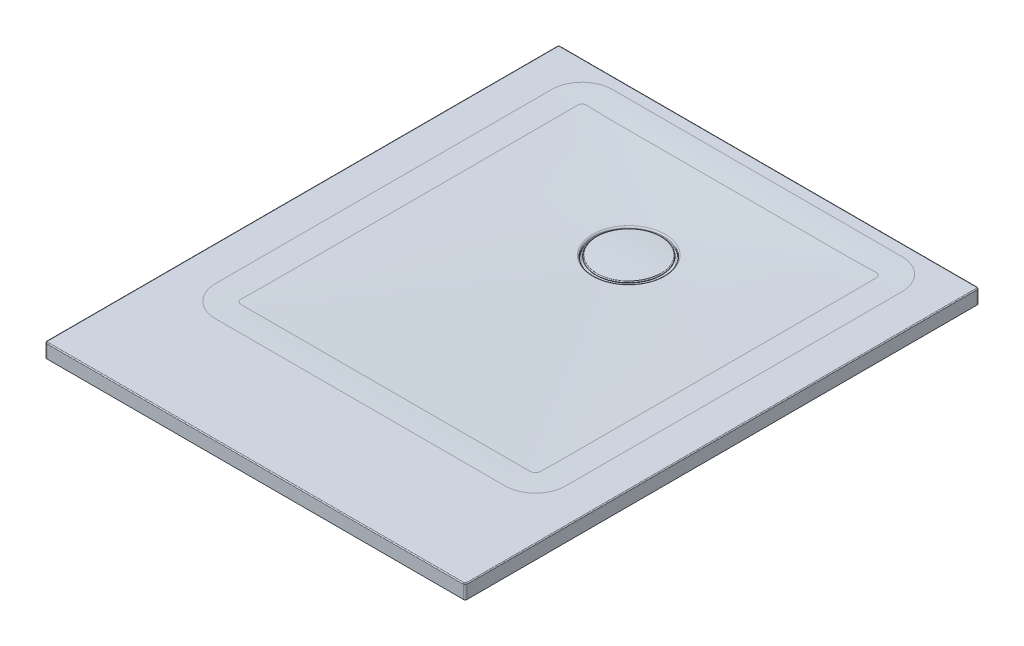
SolidWorks part; units mm, degrees
ref_plane "Płaszczyzna przednia" through (0, 0, 0) normal (0, 0, 1) x (1, 0, 0)
ref_plane "Płaszczyzna górna" through (0, 0, 0) normal (0, 1, 0) x (1, 0, 0)
ref_plane "Płaszczyzna prawa" through (0, 0, 0) normal (1, 0, 0) x (0, 0, -1)
sketch "Szkic2" plane through (0, 0, 0) normal (0, 1, 0) x (1, 0, 0)
  line L0 (0, 550) -> (0, 250) construction
  line L1 (-450, -550) -> (450, -550)
  line L2 (-450, -550) -> (-450, 550)
  line L3 (-450, 550) -> (450, 550)
  line L4 (450, -550) -> (450, 550)
  line L5 (-450, -550) -> (450, 550) construction
  line L6 (-450, 550) -> (450, -550) construction
  line L7 (-360, 510) -> (360, 510)
  line L8 (-360, 510) -> (-360, -310)
  line L9 (-360, -310) -> (360, -310)
  line L10 (360, 510) -> (360, -310)
  line L11 (-400, 550) -> (-400, -350) construction
  line L12 (-400, -350) -> (400, -350) construction
  line L13 (400, -350) -> (400, 550) construction
  circle A0 centre (0, 250) radius 75
  point P0 (0, 0)
  point P11 (0, 510)
  point P16 (0, -350)
  dimension "D9" = 150
  dimension "D1" = 900
  dimension "D2" = 1100
  dimension "D3" = 40
  dimension "D4" = 90
  dimension "D5" = 40
  dimension "D6" = 50
  dimension "D7" = 900
  dimension "D8" = 300
  dimension "D10" = 800
sketch "Szkic3" plane through (0, 0, 0) normal (0, 1, 0) x (1, 0, 0)
  line L0 (-450, -550) -> (-450, 550) construction
  line L1 (-450, -550) -> (450, -550) construction
  line L2 (450, -550) -> (450, 550) construction
  line L3 (-450, 550) -> (450, 550) construction
  line L4 (-360, 510) -> (-360, -310) construction
  line L5 (-360, 510) -> (360, 510) construction
  line L6 (360, 510) -> (360, -310) construction
  line L7 (-360, -310) -> (360, -310) construction
  line L8 (-450, -550) -> (-450, 550)
  line L9 (-450, -550) -> (450, -550)
  line L10 (450, -550) -> (450, 550)
  line L11 (-450, 550) -> (450, 550)
  line L12 (-360, 460) -> (-360, -260)
  line L13 (-310, 510) -> (310, 510)
  line L14 (360, 460) -> (360, -260)
  line L15 (-310, -310) -> (310, -310)
  arc A0 (360, 460) -> (310, 510) centre (310, 460) ccw
  arc A1 (-310, 510) -> (-360, 460) centre (-310, 460) ccw
  arc A2 (310, -310) -> (360, -260) centre (310, -260) ccw
  arc A3 (-310, -310) -> (-360, -260) centre (-310, -260) cw
  dimension "D1" = 50
surface "Powierzchnia-Płaszczyzna1" sketch "Szkic3"
sketch "Szkic4" plane through (0, 0, 0) normal (0, 1, 0) x (1, 0, 0)
  line L0 (-360, 510) -> (-360, -310) construction
  line L1 (-360, -310) -> (360, -310) construction
  line L2 (360, 510) -> (360, -310) construction
  line L3 (-360, 510) -> (360, 510) construction
  line L4 (-360, 510) -> (-360, -310)
  line L5 (-360, -310) -> (360, -310)
  line L6 (360, 510) -> (360, -310)
  line L7 (-360, 510) -> (360, 510)
ref_plane "korek" through (0, -15, 0) normal (0, 1, 0) x (-1, 0, 0)
sketch "Szkic5" plane through (0, -15, 0) normal (0, 1, 0) x (-1, 0, 0)
  circle A0 centre (0, -250) radius 75 construction
  circle A1 centre (0, -250) radius 75
surface "Powierzchnia-Wyciągnięcie po profilach2"
surface "Powierzchnia-Połącz1"
sketch "Szkic7" plane through (0, 0, 0) normal (0, 1, 0) x (1, 0, 0)
  line L27 (310, 470) -> (-310, 470)
  line L28 (-320, 460) -> (-320, -260)
  line L29 (-310, -270) -> (310, -270)
  line L30 (320, -260) -> (320, 460)
  line L31 (310, 470) -> (-310, 470)
  line L32 (-320, 460) -> (-320, -260)
  line L33 (-310, -270) -> (310, -270)
  line L34 (320, -260) -> (320, 460)
  line L35 (310, 525) -> (-310, 525)
  line L36 (-375, 460) -> (-375, -260)
  line L37 (-310, -325) -> (310, -325)
  line L38 (375, -260) -> (375, 460)
  line L39 (310, 525) -> (-310, 525)
  line L40 (-375, 460) -> (-375, -260)
  line L41 (-310, -325) -> (310, -325)
  line L42 (375, -260) -> (375, 460)
  arc A0 (320, -260) -> (310, -270) centre (310, -260) cw
  arc A1 (-320, -260) -> (-310, -270) centre (-310, -260) ccw
  arc A2 (320, 460) -> (310, 470) centre (310, 460) ccw
  arc A3 (-320, 460) -> (-310, 470) centre (-310, 460) cw
  spline S23 degree 3 poles (-642.6961, 189.4241) (147.1146, 360.1637) (326.7605, 426.9511) (319.745, 462.2677) (319.666, 462.5845) (319.4754, 463.2123) (319.3641, 463.5245) (318.988, 464.4323) (318.6811, 465.0064) (318.1375, 465.8214) (317.9415, 466.0861) (317.5237, 466.5957) (317.3039, 466.8381) (316.6125, 467.5299) (316.1097, 467.944) (315.2906, 468.4922) (315.0068, 468.6625) (314.43, 468.9712) (314.1355, 469.1107) (313.5344, 469.3602) (313.2278, 469.4704) (312.6024, 469.661) (312.2822, 469.7414) (250.628, 482.1043) (123.9223, -93.5703) (17.5595, -486.2828) knots -6.724081 -6.724081 -6.724081 -6.724081 0.125 0.125 0.1875 0.1875 0.25 0.25 0.375 0.375 0.4375 0.4375 0.5 0.5 0.625 0.625 0.6875 0.6875 0.75 0.75 0.8125 0.8125 0.875 0.875 12.74495 12.74495 12.74495 12.74495 only from (320, 460) to (310, 470)
  spline S24 degree 3 poles (-28.6406, -489.6017) (-195.2901, 254.275) (-273.2829, 477.5165) (-312.2676, 469.7447) (-312.5843, 469.6659) (-313.2123, 469.4757) (-313.5243, 469.3641) (-314.4322, 468.9881) (-315.0063, 468.6811) (-315.8213, 468.1376) (-316.086, 467.9415) (-316.5956, 467.5238) (-316.8381, 467.3039) (-317.5299, 466.6126) (-317.9438, 466.1097) (-318.4921, 465.2907) (-318.6624, 465.0069) (-318.9711, 464.4301) (-319.1106, 464.1355) (-319.3602, 463.5344) (-319.4701, 463.2278) (-319.6611, 462.6025) (-319.7417, 462.2823) (-328.5419, 418.2417) (-42.4867, 341.7495) (650.7615, 219.986) knots -7.443079 -7.443079 -7.443079 -7.443079 0.125 0.125 0.1875 0.1875 0.25 0.25 0.375 0.375 0.4375 0.4375 0.5 0.5 0.625 0.625 0.6875 0.6875 0.75 0.75 0.8125 0.8125 0.875 0.875 9.335128 9.335128 9.335128 9.335128 only from (-310, 470) to (-320, 460)
  spline S25 degree 3 poles (642.6962, 10.5759) (-147.1146, -160.1637) (-326.7605, -226.9511) (-319.745, -262.2677) (-319.666, -262.5845) (-319.4754, -263.2123) (-319.3641, -263.5245) (-318.988, -264.4323) (-318.6811, -265.0064) (-318.1375, -265.8214) (-317.9415, -266.0861) (-317.5237, -266.5957) (-317.3039, -266.8381) (-316.6125, -267.5299) (-316.1097, -267.944) (-315.2906, -268.4922) (-315.0068, -268.6625) (-314.43, -268.9712) (-314.1355, -269.1107) (-313.5344, -269.3602) (-313.2278, -269.4704) (-312.6025, -269.661) (-312.2822, -269.7414) (-250.628, -282.1043) (-123.9223, 293.5703) (-17.5595, 686.2828) knots -6.724081 -6.724081 -6.724081 -6.724081 0.125 0.125 0.1875 0.1875 0.25 0.25 0.375 0.375 0.4375 0.4375 0.5 0.5 0.625 0.625 0.6875 0.6875 0.75 0.75 0.8125 0.8125 0.875 0.875 12.74495 12.74495 12.74495 12.74495 only from (-320, -260) to (-310, -270)
  spline S26 degree 3 poles (28.6405, 689.602) (195.2901, -54.275) (273.2829, -277.5165) (312.2676, -269.7447) (312.5843, -269.6659) (313.2123, -269.4757) (313.5243, -269.3641) (314.4322, -268.9881) (315.0063, -268.6811) (315.8213, -268.1376) (316.086, -267.9415) (316.5956, -267.5238) (316.8381, -267.3039) (317.5299, -266.6126) (317.9438, -266.1097) (318.4921, -265.2907) (318.6624, -265.0069) (318.9711, -264.4301) (319.1106, -264.1355) (319.3602, -263.5344) (319.4701, -263.2278) (319.6611, -262.6025) (319.7417, -262.2823) (328.5419, -218.2417) (42.4867, -141.7495) (-650.7615, -19.986) knots -7.443079 -7.443079 -7.443079 -7.443079 0.125 0.125 0.1875 0.1875 0.25 0.25 0.375 0.375 0.4375 0.4375 0.5 0.5 0.625 0.625 0.6875 0.6875 0.75 0.75 0.8125 0.8125 0.875 0.875 9.335128 9.335128 9.335128 9.335128 only from (310, -270) to (320, -260)
  spline S31 degree 3 poles (-2447.5959, -514.3586) (-186.3327, 39.5654) (406.1978, 309.3267) (373.3423, 474.7391) (372.8284, 476.7975) (371.9012, 479.8585) (371.5656, 480.8761) (370.8439, 482.8947) (370.4595, 483.891) (368.4226, 488.8085) (366.4282, 492.5403) (363.4835, 496.9547) (362.8717, 497.8249) (361.6018, 499.5397) (360.9419, 500.3864) (358.9051, 502.8706) (357.476, 504.4468) (352.9825, 508.9435) (349.7135, 511.6343) (345.2772, 514.6046) (344.3697, 515.1803) (342.5352, 516.2815) (341.6078, 516.8074) (338.7957, 518.3123) (336.8812, 519.2189) (332.9738, 520.8414) (330.981, 521.5574) (327.9322, 522.4866) (326.906, 522.7721) (324.8333, 523.2938) (323.7849, 523.5304) (320.636, 524.1599) (318.525, 524.4739) (158.8825, 540.2582) (-61.9514, -13.8797) (-481.2983, -2354.2805) knots -4.793106 -4.793106 -4.793106 -4.793106 0.125 0.125 0.1875 0.1875 0.21875 0.21875 0.25 0.25 0.375 0.375 0.40625 0.40625 0.4375 0.4375 0.5 0.5 0.625 0.625 0.65625 0.65625 0.6875 0.6875 0.75 0.75 0.8125 0.8125 0.84375 0.84375 0.875 0.875 0.9375 0.9375 5.575774 5.575774 5.575774 5.575774 only from (375, 460) to (310, 525)
  spline S32 degree 3 poles (604.8039, -2319.2542) (49.7511, 84.8311) (-173.177, 538.8041) (-318.4946, 524.4775) (-320.5876, 524.1671) (-324.7389, 523.342) (-326.7973, 522.8284) (-329.8583, 521.9014) (-330.8759, 521.5657) (-332.8945, 520.844) (-333.8908, 520.4596) (-338.8083, 518.4227) (-342.5401, 516.4282) (-346.9546, 513.4836) (-347.8248, 512.8718) (-349.5396, 511.6019) (-350.3863, 510.942) (-352.8705, 508.9051) (-354.4467, 507.4761) (-358.9435, 502.9826) (-361.6342, 499.7135) (-364.6045, 495.2773) (-365.1803, 494.3698) (-366.2814, 492.5353) (-366.8073, 491.6079) (-368.3123, 488.7958) (-369.2189, 486.8813) (-370.8414, 482.9739) (-371.5572, 480.981) (-372.4866, 477.9323) (-372.7722, 476.9061) (-373.2939, 474.8334) (-373.5305, 473.785) (-412.4884, 278.8043) (440.5571, -14.2057) (2470.9141, -438.0158) knots -4.178485 -4.178485 -4.178485 -4.178485 0.0625 0.0625 0.125 0.125 0.1875 0.1875 0.21875 0.21875 0.25 0.25 0.375 0.375 0.40625 0.40625 0.4375 0.4375 0.5 0.5 0.625 0.625 0.65625 0.65625 0.6875 0.6875 0.75 0.75 0.8125 0.8125 0.84375 0.84375 0.875 0.875 6.648712 6.648712 6.648712 6.648712 only from (-310, 525) to (-375, 460)
  spline S33 degree 3 poles (2447.596, 714.3586) (186.3327, 160.4346) (-406.1978, -109.3267) (-373.3423, -274.7391) (-372.8284, -276.7975) (-371.9012, -279.8585) (-371.5656, -280.8761) (-370.8439, -282.8947) (-370.4595, -283.891) (-368.4226, -288.8085) (-366.4282, -292.5403) (-363.4835, -296.9547) (-362.8717, -297.8249) (-361.6018, -299.5397) (-360.9419, -300.3864) (-358.9051, -302.8706) (-357.476, -304.4468) (-352.9825, -308.9435) (-349.7135, -311.6343) (-345.2772, -314.6046) (-344.3697, -315.1803) (-342.5352, -316.2815) (-341.6078, -316.8074) (-338.7957, -318.3123) (-336.8812, -319.2189) (-332.9738, -320.8414) (-330.981, -321.5574) (-327.9322, -322.4866) (-326.906, -322.7721) (-324.8333, -323.2938) (-323.7849, -323.5304) (-320.636, -324.1599) (-318.525, -324.4739) (-158.8825, -340.2582) (61.9514, 213.8797) (481.2983, 2554.2805) knots -4.793106 -4.793106 -4.793106 -4.793106 0.125 0.125 0.1875 0.1875 0.21875 0.21875 0.25 0.25 0.375 0.375 0.40625 0.40625 0.4375 0.4375 0.5 0.5 0.625 0.625 0.65625 0.65625 0.6875 0.6875 0.75 0.75 0.8125 0.8125 0.84375 0.84375 0.875 0.875 0.9375 0.9375 5.575774 5.575774 5.575774 5.575774 only from (-375, -260) to (-310, -325)
  spline S34 degree 3 poles (-604.8039, 2519.2541) (-49.7511, 115.1689) (173.177, -338.8041) (318.4946, -324.4775) (320.5876, -324.1671) (324.7389, -323.342) (326.7973, -322.8284) (329.8583, -321.9014) (330.8759, -321.5657) (332.8945, -320.844) (333.8908, -320.4596) (338.8083, -318.4227) (342.5401, -316.4282) (346.9546, -313.4836) (347.8248, -312.8718) (349.5396, -311.6019) (350.3863, -310.942) (352.8705, -308.9051) (354.4467, -307.4761) (358.9435, -302.9826) (361.6342, -299.7135) (364.6045, -295.2773) (365.1803, -294.3698) (366.2814, -292.5353) (366.8073, -291.6079) (368.3123, -288.7958) (369.2189, -286.8813) (370.8414, -282.9739) (371.5572, -280.981) (372.4866, -277.9323) (372.7722, -276.9061) (373.2939, -274.8334) (373.5305, -273.785) (412.4884, -78.8043) (-440.5571, 214.2057) (-2470.9141, 638.0158) knots -4.178485 -4.178485 -4.178485 -4.178485 0.0625 0.0625 0.125 0.125 0.1875 0.1875 0.21875 0.21875 0.25 0.25 0.375 0.375 0.40625 0.40625 0.4375 0.4375 0.5 0.5 0.625 0.625 0.65625 0.65625 0.6875 0.6875 0.75 0.75 0.8125 0.8125 0.84375 0.84375 0.875 0.875 6.648712 6.648712 6.648712 6.648712 only from (310, -325) to (375, -260)
  spline S35 degree 3 poles (375, 460) (375, 464.2918) (374.5791, 468.512) (373.3423, 474.7391) (372.8284, 476.7975) (371.9012, 479.8585) (371.5656, 480.8761) (370.8439, 482.8947) (370.4595, 483.891) (368.4226, 488.8085) (366.4282, 492.5403) (363.4835, 496.9547) (362.8717, 497.8249) (361.6018, 499.5397) (360.9419, 500.3864) (358.9051, 502.8706) (357.476, 504.4468) (352.9825, 508.9435) (349.7135, 511.6343) (345.2772, 514.6046) (344.3697, 515.1803) (342.5352, 516.2815) (341.6078, 516.8074) (338.7957, 518.3123) (336.8812, 519.2189) (332.9738, 520.8414) (330.981, 521.5574) (327.9322, 522.4866) (326.906, 522.7721) (324.8333, 523.2938) (323.7849, 523.5304) (320.636, 524.1599) (318.525, 524.4739) (314.2799, 524.8936) (312.1459, 525) (310, 525) knots 0 0 0 0 0.125 0.125 0.1875 0.1875 0.21875 0.21875 0.25 0.25 0.375 0.375 0.40625 0.40625 0.4375 0.4375 0.5 0.5 0.625 0.625 0.65625 0.65625 0.6875 0.6875 0.75 0.75 0.8125 0.8125 0.84375 0.84375 0.875 0.875 0.9375 0.9375 1 1 1 1
  spline S36 degree 3 poles (-310, 525) (-312.1459, 525) (-314.2737, 524.8936) (-318.4946, 524.4775) (-320.5876, 524.1671) (-324.7389, 523.342) (-326.7973, 522.8284) (-329.8583, 521.9014) (-330.8759, 521.5657) (-332.8945, 520.844) (-333.8908, 520.4596) (-338.8083, 518.4227) (-342.5401, 516.4282) (-346.9546, 513.4836) (-347.8248, 512.8718) (-349.5396, 511.6019) (-350.3863, 510.942) (-352.8705, 508.9051) (-354.4467, 507.4761) (-358.9435, 502.9826) (-361.6342, 499.7135) (-364.6045, 495.2773) (-365.1803, 494.3698) (-366.2814, 492.5353) (-366.8073, 491.6079) (-368.3123, 488.7958) (-369.2189, 486.8813) (-370.8414, 482.9739) (-371.5572, 480.981) (-372.4866, 477.9323) (-372.7722, 476.9061) (-373.2939, 474.8334) (-373.5305, 473.785) (-374.5791, 468.5368) (-375, 464.2918) (-375, 460) knots 0 0 0 0 0.0625 0.0625 0.125 0.125 0.1875 0.1875 0.21875 0.21875 0.25 0.25 0.375 0.375 0.40625 0.40625 0.4375 0.4375 0.5 0.5 0.625 0.625 0.65625 0.65625 0.6875 0.6875 0.75 0.75 0.8125 0.8125 0.84375 0.84375 0.875 0.875 1 1 1 1
  spline S37 degree 3 poles (-375, -260) (-375, -264.2918) (-374.5791, -268.512) (-373.3423, -274.7391) (-372.8284, -276.7975) (-371.9012, -279.8585) (-371.5656, -280.8761) (-370.8439, -282.8947) (-370.4595, -283.891) (-368.4226, -288.8085) (-366.4282, -292.5403) (-363.4835, -296.9547) (-362.8717, -297.8249) (-361.6018, -299.5397) (-360.9419, -300.3864) (-358.9051, -302.8706) (-357.476, -304.4468) (-352.9825, -308.9435) (-349.7135, -311.6343) (-345.2772, -314.6046) (-344.3697, -315.1803) (-342.5352, -316.2815) (-341.6078, -316.8074) (-338.7957, -318.3123) (-336.8812, -319.2189) (-332.9738, -320.8414) (-330.981, -321.5574) (-327.9322, -322.4866) (-326.906, -322.7721) (-324.8333, -323.2938) (-323.7849, -323.5304) (-320.636, -324.1599) (-318.525, -324.4739) (-314.2799, -324.8936) (-312.1459, -325) (-310, -325) knots 0 0 0 0 0.125 0.125 0.1875 0.1875 0.21875 0.21875 0.25 0.25 0.375 0.375 0.40625 0.40625 0.4375 0.4375 0.5 0.5 0.625 0.625 0.65625 0.65625 0.6875 0.6875 0.75 0.75 0.8125 0.8125 0.84375 0.84375 0.875 0.875 0.9375 0.9375 1 1 1 1
  spline S38 degree 3 poles (310, -325) (312.1459, -325) (314.2737, -324.8936) (318.4946, -324.4775) (320.5876, -324.1671) (324.7389, -323.342) (326.7973, -322.8284) (329.8583, -321.9014) (330.8759, -321.5657) (332.8945, -320.844) (333.8908, -320.4596) (338.8083, -318.4227) (342.5401, -316.4282) (346.9546, -313.4836) (347.8248, -312.8718) (349.5396, -311.6019) (350.3863, -310.942) (352.8705, -308.9051) (354.4467, -307.4761) (358.9435, -302.9826) (361.6342, -299.7135) (364.6045, -295.2773) (365.1803, -294.3698) (366.2814, -292.5353) (366.8073, -291.6079) (368.3123, -288.7958) (369.2189, -286.8813) (370.8414, -282.9739) (371.5572, -280.981) (372.4866, -277.9323) (372.7722, -276.9061) (373.2939, -274.8334) (373.5305, -273.785) (374.5791, -268.5368) (375, -264.2918) (375, -260) knots 0 0 0 0 0.0625 0.0625 0.125 0.125 0.1875 0.1875 0.21875 0.21875 0.25 0.25 0.375 0.375 0.40625 0.40625 0.4375 0.4375 0.5 0.5 0.625 0.625 0.65625 0.65625 0.6875 0.6875 0.75 0.75 0.8125 0.8125 0.84375 0.84375 0.875 0.875 1 1 1 1
  dimension "D3" = 10
  dimension "D1" = 40
  dimension "D2" = 15
other "Usuń ścianę1"
other "Granica-Powierzchnia1"
surface "Powierzchnia-Połącz2"
sketch "Szkic9" plane through (0, 0, 0) normal (0, 1, 0) x (1, 0, 0)
  line L0 (-450, -550) -> (450, -550) construction
  line L1 (-450, -550) -> (-450, 550) construction
  line L2 (450, -550) -> (450, 550) construction
  line L3 (-450, 550) -> (450, 550) construction
  line L4 (-450, -550) -> (450, -550)
  line L5 (-450, -550) -> (-450, 550)
  line L6 (450, -550) -> (450, 550)
  line L7 (-450, 550) -> (450, 550)
surface "Powierzchnia-Wyciągnięcie1" sketch "Szkic9" parameters "D1"=30
sketch "Szkic8" plane through (0, 0, 0) normal (1, 0, 0) x (0, 0, -1)
  line L0 (250, 0) -> (250, -30) construction
  line L1 (174.9999, -15) -> (175.2968, -23.5)
  line L4 (175.2968, -23.5) -> (198, -24.0945)
  line L5 (175.2968, -23.5) -> (250, -23.5) construction
  line L6 (198, -24.0945) -> (198, -30) construction
  line L7 (250, -30) -> (175.2968, -30) construction
  line L8 (175.2968, -30) -> (175.2968, -23.5) construction
  line L9 (205, -28) -> (205, -30)
  line L10 (198, -24.0945) -> (205, -28)
  dimension "D1" = 30
  dimension "D2" = 8.5
  dimension "D3" = 2
  dimension "D4" = 1.5
  dimension "D5" = 52
  dimension "D6" = 45
  dimension "D7" = 2
surface "Powierzchnia-Obrót1" sketch "Szkic8" parameters "D1"=360
surface "Powierzchnia-Płaszczyzna2"
surface "Powierzchnia-Połącz3"
fillet "Zaokrąglenie4" radius 4 4 edges at (-450, -15, -550) (450, -15, -550) (-450, -15, 550) (450, -15, 550)
fillet "Zaokrąglenie5" radius 3 3 edges at (0, -24.0945, -302) (0, -23.5, -324.7032)
fillet "Zaokrąglenie6" radius 2 9 edges at (448.8284, 0, 548.8284) (0, 0, 550) (-448.8284, 0, 548.8284) (-450, 0, 0) (-448.8284, 0, -548.8284) (0, 0, -550) (448.8284, 0, -548.8284) (450, 0, 0) (0, -28, -295)
sketch "Szkic11" plane through (0, 0, 0) normal (1, 0, 0) x (0, 0, -1)
  line L0 (250, 0) -> (250, -30) construction
  line L1 (-546, -30) -> (546, -30) construction
  line L2 (250, -17) -> (250, -11.5)
  line L14 (320, -11.5) -> (320, -14.5) construction
  line L16 (320, -17) -> (250, -17)
  line L18 (320, -17) -> (320, -16.3377)
  line L19 (250, -11.5) -> (320, -11.5) construction
  arc A0 (320, -16.3377) -> (318.1666, -14.3446) centre (318, -16.3377) ccw
  arc A6 (318.1666, -14.3446) -> (250, -11.5) centre (250, -829.6667) ccw
  dimension "D2" = 2
  dimension "D8" = 2.5
  dimension "D9" = 17
  dimension "D10" = 5.5
  dimension "D11" = 70
revolve "Obrót1" add sketch "Szkic11" angle 360 about L0
